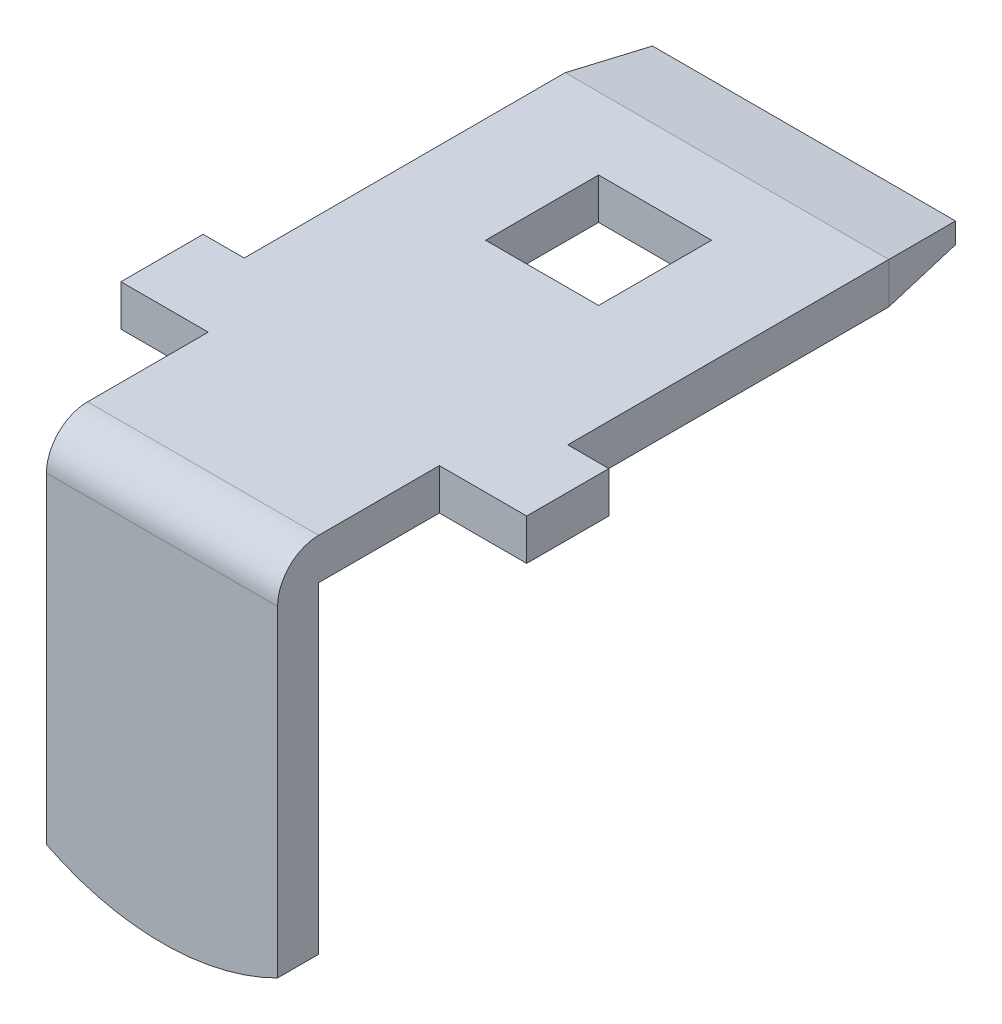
SolidWorks part; units mm, degrees
ref_plane "Front Plane" through (0, 0, 0) normal (0, 0, 1) x (1, 0, 0)
ref_plane "Top Plane" through (0, 0, 0) normal (0, 1, 0) x (1, 0, 0)
ref_plane "Right Plane" through (0, 0, 0) normal (1, 0, 0) x (0, 0, -1)
ref_plane "Plane1" through (0, 0, -22.8) normal (0, 0, -1) x (-1, 0, 0)
sketch "Sketch1" plane through (0, 0, -22.8) normal (0, 0, -1) x (-1, 0, 0)
  line L0 (-57.75, 308.6) -> (-62.25, 308.6)
  line L1 (-62.25, 308.6) -> (-62.25, 301.5349)
  line L2 (-57.75, 301.5349) -> (-57.75, 308.6)
  arc A0 (-62.25, 301.5349) -> (-57.75, 301.5349) centre (-60, 306) ccw
extrude "Extrude1" add sketch "Sketch1" against normal blind 12.5
sketch "Sketch2" plane through (0, 0, -22.8) normal (0, 0, -1) x (-1, 0, 0)
  line L0 (-57.75, 307.8) -> (-62.25, 307.8)
  line L1 (-62.25, 307.8) -> (-62.25, 301.5349)
  line L2 (-57.75, 301.5349) -> (-57.75, 307.8)
  arc A0 (-62.25, 301.5349) -> (-57.75, 301.5349) centre (-60, 306) ccw
extrude "Extrude2" cut sketch "Sketch2" against normal blind 11.7
sketch "Sketch3" plane through (62.25, 0, 0) normal (1, 0, 0) x (0, 0, -1)
  line L0 (22.8, 307.8) -> (13.45, 307.8)
  line L1 (13.45, 307.8) -> (13.45, 308.6)
  line L2 (13.45, 308.6) -> (22.8, 308.6)
  line L3 (22.8, 308.6) -> (22.8, 307.8)
extrude "Extrude3" add sketch "Sketch3" along normal blind 1.7
sketch "Sketch4" plane through (57.75, 0, 0) normal (-1, 0, 0) x (0, 0, 1)
  line L0 (-13.45, 307.8) -> (-22.8, 307.8)
  line L1 (-22.8, 307.8) -> (-22.8, 308.6)
  line L2 (-22.8, 308.6) -> (-13.45, 308.6)
  line L3 (-13.45, 308.6) -> (-13.45, 307.8)
extrude "Extrude4" add sketch "Sketch4" along normal blind 1.7
sketch "Sketch5" plane through (0, 307.8, 0) normal (0, -1, 0) x (1, 0, 0)
  line L0 (63.15, -15.05) -> (63.15, -22.8)
  line L1 (63.15, -22.8) -> (63.95, -22.8)
  line L2 (63.95, -22.8) -> (63.95, -15.05)
  line L3 (63.95, -15.05) -> (63.15, -15.05)
extrude "Extrude5" cut sketch "Sketch5" against normal through all
sketch "Sketch6" plane through (0, 307.8, 0) normal (0, -1, 0) x (1, 0, 0)
  line L0 (56.85, -15.05) -> (56.05, -15.05)
  line L1 (56.05, -15.05) -> (56.05, -22.8)
  line L2 (56.05, -22.8) -> (56.85, -22.8)
  line L3 (56.85, -22.8) -> (56.85, -15.05)
extrude "Extrude6" cut sketch "Sketch6" against normal through all
sketch "Sketch7" plane through (0, 307.8, 0) normal (0, -1, 0) x (1, 0, 0)
  line L0 (58.9, -17.7) -> (58.9, -19.9)
  line L1 (58.9, -19.9) -> (61.1, -19.9)
  line L2 (61.1, -19.9) -> (61.1, -17.7)
  line L3 (61.1, -17.7) -> (58.9, -17.7)
extrude "Extrude7" cut sketch "Sketch7" against normal through all
chamfer "Chamfer1" distance 0.2 angle 82.405
fillet "Fillet1" radius 0.8
